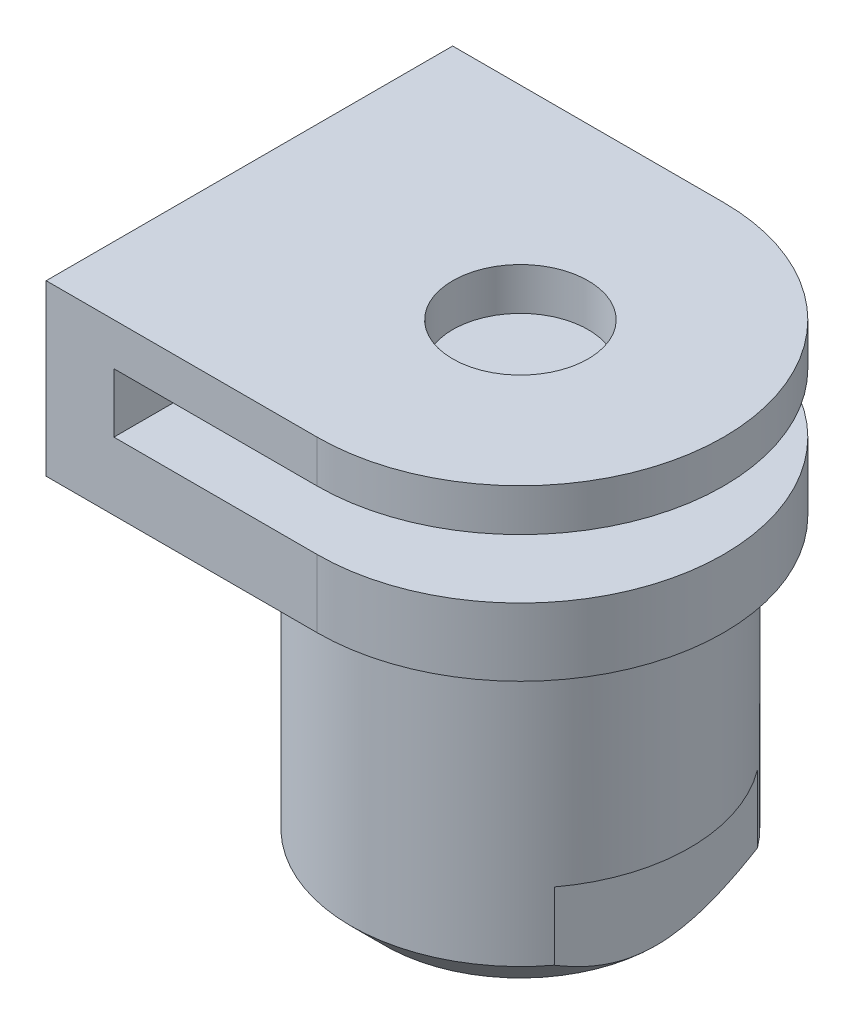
SolidWorks part; units mm, degrees
ref_plane "Спереди" through (0, 0, 0) normal (0, 0, 1) x (1, 0, 0)
ref_plane "Сверху" through (0, 0, 0) normal (0, 1, 0) x (1, 0, 0)
ref_plane "Справа" through (0, 0, 0) normal (1, 0, 0) x (0, 0, -1)
sketch "Эскиз1" plane through (0, 0, 0) normal (0, 1, 0) x (1, 0, 0)
  circle A0 centre (0, 0) radius 5
  circle A1 centre (0, 0) radius 2
  dimension "D1" = 10
  dimension "D2" = 4
extrude "Бобышка-Вытянуть1" add sketch "Эскиз1" along normal blind 9
chamfer "Фаска1" distance 1 angle 45 1 edges at (0, 0, 5)
sketch "Эскиз2" plane through (0, 0, 0) normal (0, -1, 0) x (-1, 0, 0)
  line L1 (4, 5.4258) -> (-4, 5.4258) construction
  line L2 (4, 5.4258) -> (4, -5.4258) construction
  line L3 (4, -5.4258) -> (-4, -5.4258) construction
  line L4 (-4, 5.4258) -> (-4, -5.4258) construction
  line L5 (4, 5.4258) -> (-4, -5.4258) construction
  line L6 (4, -5.4258) -> (-4, 5.4258) construction
  line L7 (4, -5.4258) -> (9.2049, -5.4258)
  line L8 (4, -5.4258) -> (4, 5.6174)
  line L9 (4, 5.6174) -> (9.2049, 5.6174)
  line L10 (9.2049, -5.4258) -> (9.2049, 5.6174)
  line L11 (-4, -5.4258) -> (-9.6672, -5.4258)
  line L12 (-4, -5.4258) -> (-4, 5.6174)
  line L13 (-4, 5.6174) -> (-9.6672, 5.6174)
  line L14 (-9.6672, -5.4258) -> (-9.6672, 5.6174)
  point P0 (0, 0)
  dimension "D1" = 8
extrude "Вырез-Вытянуть1" cut sketch "Эскиз2" against normal blind 3
sketch "Эскиз3" plane through (0, 9, 0) normal (0, 1, 0) x (1, 0, 0)
  line L0 (0, 6) -> (-6, 6)
  line L1 (-6, 6) -> (-6, -6)
  line L2 (-6, -6) -> (0, -6)
  arc A0 (0, -6) -> (0, 6) centre (0, 0) ccw
  circle A1 centre (0, 0) radius 2
  dimension "D1" = 12
extrude "Бобышка-Вытянуть2" add sketch "Эскиз3" along normal blind 2
sketch "Эскиз4" plane through (0, 11, 0) normal (0, 1, 0) x (1, 0, 0)
  line L1 (-6, 6) -> (-8, 6)
  line L2 (-6, 6) -> (-6, -6)
  line L3 (-6, -6) -> (-8, -6)
  line L4 (-8, 6) -> (-8, -6)
  dimension "D1" = 2
extrude "Бобышка-Вытянуть3" add sketch "Эскиз4" along normal blind 3 and the other way blind 2
sketch "Эскиз5" plane through (0, 14, 0) normal (0, 1, 0) x (1, 0, 0)
  line L1 (-8, 6) -> (0, 6)
  line L2 (-8, 6) -> (-8, -6)
  line L3 (-8, -6) -> (0, -6)
  arc A0 (0, -6) -> (0, 6) centre (0, 0) ccw
  circle A1 centre (0, 0) radius 2
  dimension "D1" = 4
extrude "Бобышка-Вытянуть4" add sketch "Эскиз5" against normal blind 1.25
sketch3d "Трехмерный эскиз1"
  line L0 (-8, 9, 0) -> (-5, 9, 0)
  line L1 (-8, 9, -6) -> (-8, 9, 6) construction
  line L2 (-5, 9, 0) -> (-5, 5, 0)
  line L3 (-5, 5, 0) -> (-8, 9, 0)
  circle A0 centre (0, 9, 0) radius 5 construction
  point P6 (0, 14, 0)
  point P8 (-4, 0, 0)
  dimension "D1" = 4
extrude "Бобышка-Вытянуть6" add sketch "Трехмерный эскиз1" along direction (0, 0, 1) on the side of the normal blind 0.5 and the other way blind 0.5 separate body contours L0 L2 L3
sketch "Эскиз7" plane through (-5, 0, 0) normal (1, 0, 0) x (0, 0, -1)
  line L8 (0.5, 5) -> (0.5, 9)
  line L9 (0.5, 9) -> (-0.5, 9)
  line L10 (-0.5, 9) -> (-0.5, 5)
  line L11 (-0.5, 5) -> (0.5, 5)
  line L12 (0.5, 5) -> (0.5, 9)
  line L13 (0.5, 9) -> (-0.5, 9)
  line L14 (-0.5, 9) -> (-0.5, 5)
  line L15 (-0.5, 5) -> (0.5, 5)
  dimension "D1" = 0
extrude "Бобышка-Вытянуть7" add sketch "Эскиз7" along normal up to surface
sketch "Эскиз8" plane through (0, 9, 0) normal (0, -1, 0) x (1, 0, 0)
  line L0 (0, -6) -> (0, -5)
  arc A0 (-4.9749, -0.5) -> (-4.9749, 0.5) centre (0, 0) ccw construction
